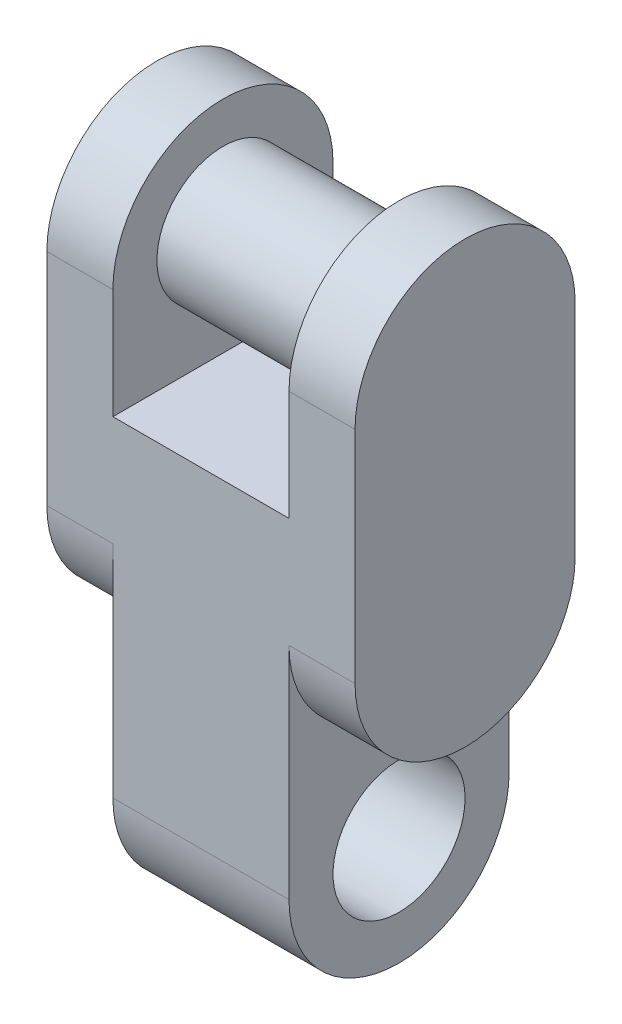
SolidWorks part; units mm, degrees
ref_plane "Front Plane" through (0, 0, 0) normal (0, 0, 1) x (1, 0, 0)
ref_plane "Top Plane" through (0, 0, 0) normal (0, 1, 0) x (1, 0, 0)
ref_plane "Right Plane" through (0, 0, 0) normal (1, 0, 0) x (0, 0, -1)
sketch "Sketch1" plane through (0, 0, 0) normal (0, 0, 1) x (1, 0, 0)
  line L0 (-36.8928, 8.8585) -> (-33.8928, 8.8585)
  line L1 (-47.8928, 28.8585) -> (-47.8928, 8.8585)
  line L2 (-47.8928, 8.8585) -> (-44.8928, 8.8585)
  line L3 (-33.8928, 8.8585) -> (-33.8928, 28.8585)
  line L4 (-36.8928, 28.8585) -> (-33.8928, 28.8585)
  line L6 (-40.8928, -1.1415) -> (-36.8928, -1.1415)
  line L7 (-47.8928, 28.8585) -> (-44.8928, 28.8585)
  line L9 (-44.8928, 28.8585) -> (-44.8928, 18.8585)
  line L10 (-44.8928, 18.8585) -> (-36.8928, 18.8585)
  line L11 (-36.8928, 28.8585) -> (-36.8928, 18.8585)
  line L16 (-44.8928, 8.8585) -> (-44.8928, -1.1415)
  line L17 (-44.8928, -1.1415) -> (-36.8928, -1.1415)
  line L18 (-36.8928, 8.8585) -> (-36.8928, -1.1415)
extrude "Boss-Extrude1" add sketch "Sketch1" along normal blind 10 contours L18 L0 L3 L4 L11 L10 L9 L7 L1 L2 L16 L17 L6
sketch "Sketch2" plane through (-36.8928, 0, 0) normal (1, 0, 0) x (0, 0, -1)
  line L0 (-10, 3.8585) -> (-10, -1.1415)
  line L1 (-10, -1.1415) -> (0, -1.1415)
  line L2 (0, -1.1415) -> (0, 3.8585)
  circle A0 centre (-5, 3.8585) radius 3
  circle A1 centre (-5, 3.8585) radius 5
extrude "Cut-Extrude1" cut sketch "Sketch2" against normal blind 10 contours A0 | A1 M3 M4 | A1 L1 M1
sketch "Sketch3" plane through (-44.8928, 0, 0) normal (1, 0, 0) x (0, 0, -1)
  circle A0 centre (-5, 23.9948) radius 3
extrude "Boss-Extrude2" add sketch "Sketch3" along normal blind 8
sketch "Sketch5" plane through (-33.8928, 0, 0) normal (1, 0, 0) x (0, 0, -1)
  line L1 (-10, 23.8585) -> (-10, 28.8585)
  line L2 (-10, 28.8585) -> (0, 28.8585)
  line L3 (0, 28.8585) -> (0, 23.8585)
  circle A1 centre (-5, 23.8585) radius 5
extrude "Cut-Extrude2" cut sketch "Sketch5" against normal blind 26 contours A1 L2 M3 | A1 M1 M2
sketch "Sketch6" plane through (-33.8928, 0, 0) normal (1, 0, 0) x (0, 0, -1)
  line L1 (-10, 13.8585) -> (-10, 8.8585)
  line L2 (-10, 8.8585) -> (0, 8.8585)
  line L3 (0, 8.8585) -> (0, 13.8585)
  circle A1 centre (-5, 13.8585) radius 5
extrude "Cut-Extrude3" cut sketch "Sketch6" against normal blind 3 contours A1 M3 M4 | A1 L2 M1
sketch "Sketch7" plane through (-47.8928, 0, 0) normal (-1, 0, 0) x (0, 0, 1)
  line L1 (0, 13.8585) -> (0, 8.8585)
  line L2 (0, 8.8585) -> (10, 8.8585)
  line L3 (10, 8.8585) -> (10, 13.8585)
  circle A1 centre (5, 13.8585) radius 5
extrude "Cut-Extrude4" cut sketch "Sketch7" against normal blind 3 contours A1 M2 M3 | A1 L2 M4
